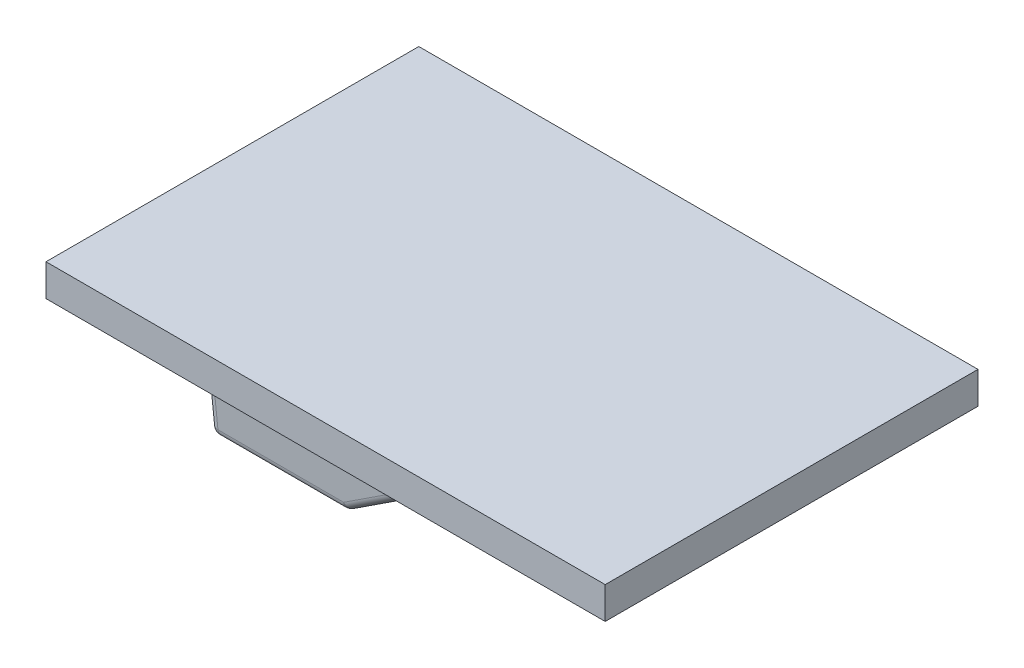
SolidWorks part; units mm, degrees
ref_plane "Front Plane" through (0, 0, 0) normal (0, 0, 1) x (1, 0, 0)
ref_plane "Top Plane" through (0, 0, 0) normal (0, 1, 0) x (1, 0, 0)
ref_plane "Right Plane" through (0, 0, 0) normal (1, 0, 0) x (0, 0, -1)
surface "Surface-Radiate1" parameters "D1"=9
surface "Surface-Knit1"
ref_plane "Plane1" through (0, 84.1857, 0) normal (0, 1, 0) x (1, 0, 0)
sketch "Sketch2" plane through (0, 84.1857, 0) normal (0, 1, 0) x (1, 0, 0)
  line L0 (219.7334, -115.5) -> (219.7334, 115.5) construction
  line L1 (-196.2666, -135.5) -> (199.7334, -135.5) construction
  line L2 (-216.2666, 115.5) -> (-216.2666, -115.5) construction
  line L3 (199.7334, 135.5) -> (-196.2666, 135.5) construction
  line L4 (219.7334, -115.5) -> (219.7334, 115.5)
  line L5 (-196.2666, -135.5) -> (199.7334, -135.5)
  line L6 (-216.2666, 115.5) -> (-216.2666, -115.5)
  line L7 (199.7334, 135.5) -> (-196.2666, 135.5)
  arc A0 (219.7334, 115.5) -> (199.7334, 135.5) centre (199.7334, 115.5) ccw construction
  arc A1 (199.7334, -135.5) -> (219.7334, -115.5) centre (199.7334, -115.5) ccw construction
  arc A2 (-216.2666, -115.5) -> (-196.2666, -135.5) centre (-196.2666, -115.5) ccw construction
  arc A3 (-196.2666, 135.5) -> (-216.2666, 115.5) centre (-196.2666, 115.5) ccw construction
  arc A4 (219.7334, 115.5) -> (199.7334, 135.5) centre (199.7334, 115.5) ccw
  arc A5 (199.7334, -135.5) -> (219.7334, -115.5) centre (199.7334, -115.5) ccw
  arc A6 (-216.2666, -115.5) -> (-196.2666, -135.5) centre (-196.2666, -115.5) ccw
  arc A7 (-196.2666, 135.5) -> (-216.2666, 115.5) centre (-196.2666, 115.5) ccw
extrude "Boss-Extrude1" add sketch "Sketch2" against normal up to surface (30 mm away)
sketch "Sketch3" plane through (0, 84.1857, 0) normal (0, 1, 0) x (1, 0, 0)
  line L1 (-262.5, -175) -> (262.5, -175)
  line L2 (-262.5, -175) -> (-262.5, 175)
  line L3 (-262.5, 175) -> (262.5, 175)
  line L4 (262.5, -175) -> (262.5, 175)
  line L5 (-262.5, -175) -> (262.5, 175) construction
  line L6 (-262.5, 175) -> (262.5, -175) construction
  point P0 (0, 0)
  dimension "D1" = 525
  dimension "D2" = 350
extrude "Boss-Extrude2" add sketch "Sketch3" against normal blind 30 contours L1 L4 L3 L2 M3 M10 M9 M8 M7 M6 M5 M4
